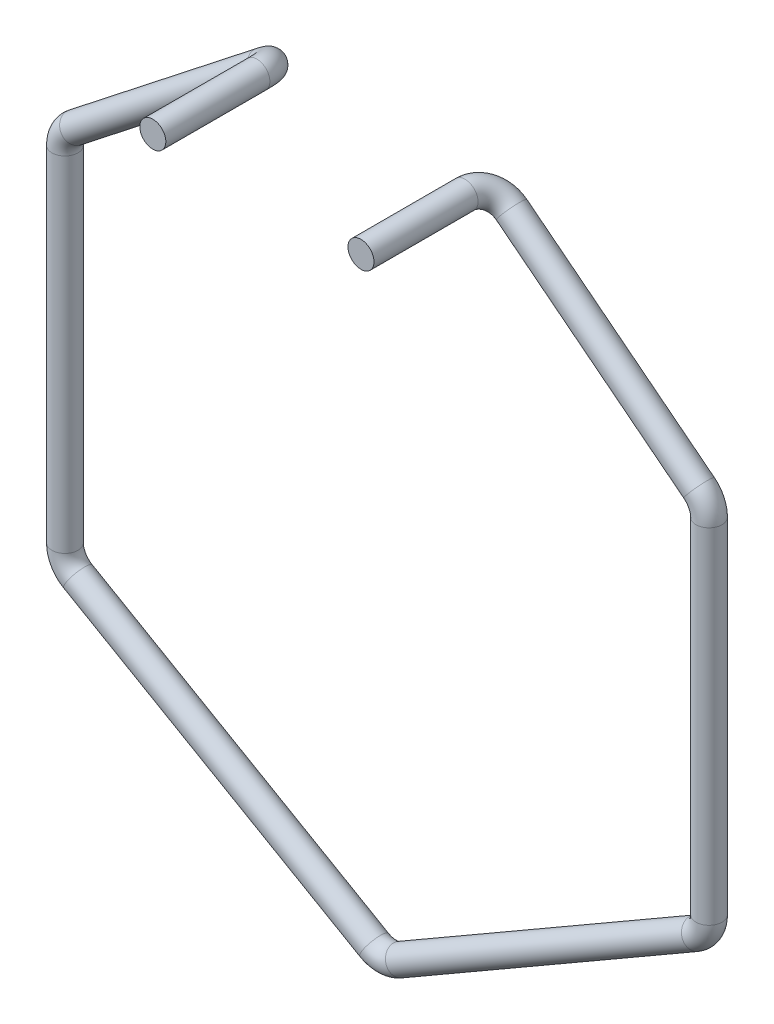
SolidWorks part; units mm, degrees
ref_plane "Face" through (0, 0, 0) normal (0, 0, 1) x (1, 0, 0)
ref_plane "Dessus" through (0, 0, 0) normal (0, 1, 0) x (1, 0, 0)
ref_plane "Côté" through (0, 0, 0) normal (1, 0, 0) x (0, 0, -1)
sketch "Esquisse1" plane through (0, 0, 0) normal (0, 0, 1) x (1, 0, 0)
  line L1 (74.2617, 42.875) -> (74.2617, -42.875) construction
  line L2 (74.2617, -42.875) -> (0, -85.75) construction
  line L3 (0, -85.75) -> (-74.2617, -42.875) construction
  line L4 (-74.2617, -42.875) -> (-74.2617, 42.875) construction
  line L5 (-74.2617, 42.875) -> (-24, 82.3229) construction
  line L6 (74.2617, 42.875) -> (24, 82.3229) construction
  circle A0 centre (0, 0) radius 85.75 construction
  dimension "D1" = 171.5
  dimension "D2" = 48
ref_plane "Plan1" through (0, 0, 30) normal (0, 0, 1) x (1, 0, 0)
sketch3d "3DSketch4"
  line L0 (28.7199, 78.6185, 0) -> (71.9661, 44.6767, 0)
  line L1 (74.2617, 39.9568, 0) -> (74.2617, -39.4109, 0)
  line L2 (71.2617, -44.6071, 0) -> (3, -84.0179, 0)
  line L3 (-3, -84.0179, 0) -> (-71.2617, -44.6071, 0)
  line L4 (-74.2617, -39.4109, 0) -> (-74.2617, 39.9568, 0)
  line L5 (-71.9661, 44.6767, 0) -> (-28.7199, 78.6185, 0)
  line L6 (-24, 82.3229, 6) -> (-24, 82.3229, 30)
  line L7 (24, 82.3229, 6) -> (24, 82.3229, 30)
  line L8 (0, -85.75, 0) -> (-74.2617, -42.875, 0) construction
  line L9 (74.2617, -42.875, 0) -> (0, -85.75, 0) construction
  arc A0 (74.2617, 39.9568, 0) -> (71.9661, 44.6767, 0) centre (68.2617, 39.9568, 0) ccw
  arc A1 (-24, 82.3229, 6) -> (-28.7199, 78.6185, 0) centre (-28.7199, 78.6185, 6) ccw
  arc A2 (24, 82.3229, 6) -> (28.7199, 78.6185, 0) centre (28.7199, 78.6185, 6) ccw
  arc A3 (71.2617, -44.6071, 0) -> (74.2617, -39.4109, 0) centre (68.2617, -39.4109, 0) ccw
  arc A4 (-74.2617, -39.4109, 0) -> (-71.2617, -44.6071, 0) centre (-68.2617, -39.4109, 0) ccw
  arc A5 (-3, -84.0179, 0) -> (3, -84.0179, 0) centre (0, -78.8218, 0) ccw
  arc A6 (-71.9661, 44.6767, 0) -> (-74.2617, 39.9568, 0) centre (-68.2617, 39.9568, 0) ccw
  point P15 (74.2617, 42.875, 0)
  point P19 (68.2617, 39.9568, 6)
  point P22 (-24, 82.3229, 0)
  point P23 (-32.4243, 83.3384, 6)
  point P26 (24, 82.3229, 0)
  point P27 (25.0155, 73.8986, 6)
  point P30 (74.2617, -42.875, 0)
  point P31 (68.2617, -39.4109, 6)
  point P34 (-74.2617, -42.875, 0)
  point P35 (-68.2617, -39.4109, 6)
  point P42 (0, -85.75, 0)
  point P43 (0, -78.8218, 6)
  point P46 (-74.2617, 42.875, 0)
  point P47 (-68.2617, 39.9568, 6)
  dimension "D3" = 6
  dimension "D4" = 6
  dimension "D5" = 6
  dimension "D6" = 6
  dimension "D7" = 6
  dimension "D8" = 6
  dimension "D9" = 6
  dimension "D1" = 30
  dimension "D2" = 30
ref_plane "Plan2" through (0, 0, 30) normal (0, 0, 1) x (1, 0, 0)
sketch "Esquisse3" plane through (0, 0, 30) normal (0, 0, 1) x (1, 0, 0)
  circle A0 centre (-24, 82.3229) radius 3
  dimension "D1" = 6
sweep "Base-Balayage" add profiles "Esquisse3" path "3DSketch4"
sketch "Esquisse4" plane through (0, 0, 0) normal (1, 0, 0) x (0, 0, -1)
  line L0 (-28.4793, 0) -> (30.9214, 0) construction
